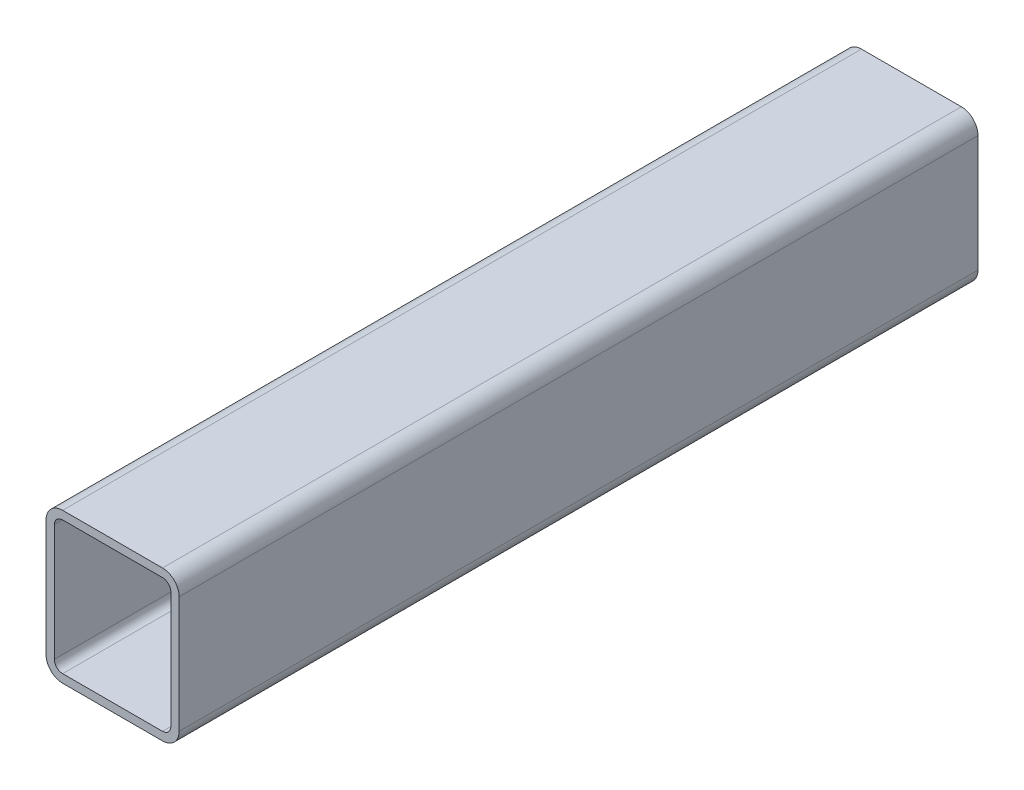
SolidWorks part; units mm, degrees
ref_plane "Front Plane" through (0, 0, 0) normal (0, 0, 1) x (1, 0, 0)
ref_plane "Top Plane" through (0, 0, 0) normal (0, 1, 0) x (1, 0, 0)
ref_plane "Right Plane" through (0, 0, 0) normal (1, 0, 0) x (0, 0, -1)
sketch "Sketch1" plane through (0, 0, 0) normal (0, 0, 1) x (1, 0, 0)
  line B0 (6.35, 57.15) -> (44.45, 57.15)
  arc B1 (50.8, 50.8) -> (44.45, 57.15) centre (44.45, 50.8) ccw
  line B2 (50.8, 50.8) -> (50.8, 6.35)
  arc B3 (44.45, 0) -> (50.8, 6.35) centre (44.45, 6.35) ccw
  line B4 (44.45, 0) -> (6.35, 0)
  arc B5 (0, 6.35) -> (6.35, 0) centre (6.35, 6.35) ccw
  line B6 (0, 6.35) -> (0, 50.8)
  arc B7 (6.35, 57.15) -> (0, 50.8) centre (6.35, 50.8) ccw
  line B8 (6.35, 53.975) -> (44.45, 53.975)
  arc B9 (47.625, 50.8) -> (44.45, 53.975) centre (44.45, 50.8) ccw
  line B10 (47.625, 50.8) -> (47.625, 6.35)
  arc B11 (44.45, 3.175) -> (47.625, 6.35) centre (44.45, 6.35) ccw
  line B12 (44.45, 3.175) -> (6.35, 3.175)
  arc B13 (3.175, 6.35) -> (6.35, 3.175) centre (6.35, 6.35) ccw
  line B14 (3.175, 6.35) -> (3.175, 50.8)
  arc B15 (6.35, 53.975) -> (3.175, 50.8) centre (6.35, 50.8) ccw
sketch_block_instance "HSS2.25x2x0.125-1"
sketch_block "HSS2.25x2x0.125"
extrude "Boss-Extrude1" add sketch "Sketch1" along normal blind 304.8
